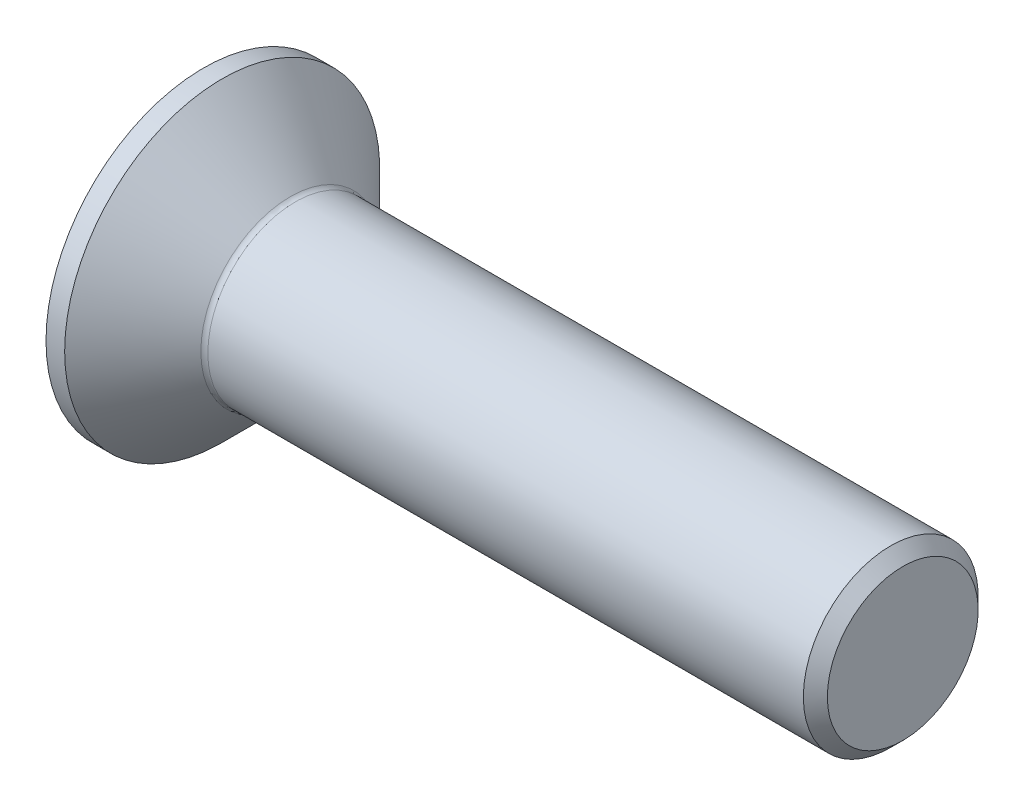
SolidWorks part; units mm, degrees
ref_plane "Plane1" through (0, 0, 0) normal (0, 0, 1) x (1, 0, 0)
ref_plane "Plane2" through (0, 0, 0) normal (0, 1, 0) x (1, 0, 0)
ref_plane "Plane3" through (0, 0, 0) normal (1, 0, 0) x (0, 0, -1)
sketch "BodySke" plane through (0, 0, 0) normal (0, 0, 1) x (1, 0, 0)
  line L0 (0, 0) -> (0, 18.025)
  line L1 (2.135, 18.025) -> (10.16, 10)
  line L2 (0, 18.025) -> (2.135, 18.025)
  line L3 (10.16, 10) -> (78.626, 10)
  line L4 (80, 8.626) -> (80, 0)
  line L5 (80, 0) -> (0, 0)
  line L6 (0, 0) -> (127, 0) construction
  line L7 (2.135, -18.025) -> (10.16, -10) construction
  line L8 (80, 8.626) -> (78.626, 10)
  line L9 (0, -18.025) -> (2.135, -18.025) construction
  line L10 (80, -8.626) -> (78.626, -10) construction
  line L11 (12.66, 16.35) -> (12.66, -5.875) construction
  line L12 (0, 19.05) -> (0, -3.175) construction
  dimension "D1" = 2.135
  dimension "Diameter" = 20
  dimension "Head_ht" = 10.16
  dimension "Length" = 80
  dimension "Body_ch_ang" = 45
  dimension "Head_dia" = 36.05
  dimension "Minor_dia" = 17.252
  dimension "Head_ang" = 90
  dimension "Advance" = 2.5
  dimension "Thread_nom" = 80
revolve "BaseBody" add sketch "BodySke" angle 360 about L6
fillet "Fillet1" radius 0.8 1 edges at (10.16, 0, 10)
sketch "Sketch2" plane through (0, 0, 0) normal (0, 0, 1) x (1, 0, 0)
  line L0 (0, 6) -> (5.6, 6)
  line L1 (5.6, 6) -> (9.0641, 0)
  line L2 (0, 0) -> (127, 0) construction
  line L3 (9.0641, 0) -> (0, 0)
  line L4 (0, 0) -> (0, 6)
  line L5 (0, -6) -> (5.6, -6) construction
  line L6 (0, 0) -> (47.625, 0) construction
  line L8 (0, 18.025) -> (0, -18.025) construction
  dimension "D2" = 60
  dimension "PreBroach_depth" = 5.6
  dimension "PreBroach_dia" = 12
revolve "PreBroach" cut sketch "Sketch2" angle 360 about L6
sketch "Sketch3" plane through (0, 0, 0) normal (-1, 0, 0) x (0, 0, 1)
  line L0 (-6, -3.4641) -> (-6, 3.4641)
  line L1 (-6, 3.4641) -> (0, 6.9282)
  line L2 (0, 6.9282) -> (6, 3.4641)
  line L3 (6, 3.4641) -> (6, -3.4641)
  line L4 (6, -3.4641) -> (0, -6.9282)
  line L5 (0, -6.9282) -> (-6, -3.4641)
  dimension "D1" = 6
  dimension "D2" = 6
  dimension "D3" = 12
  dimension "Hex_size" = 12
extrude "Hex" cut sketch "Sketch3" against normal blind 5.6
sketch "ThdSchSke" plane through (0, 0, 0) normal (0, 0, 1) x (1, 0, 0)
  line L0 (15.16, -8.626) -> (14.1979, -10)
  line L1 (15.16, -8.626) -> (16.1221, -10)
  line L2 (16.1221, -10) -> (16.1221, -12.5)
  line L3 (-3.175, 0) -> (5.1513, 0) construction
  line L4 (0, 18.025) -> (0, -18.025) construction
  line L5 (16.1221, -12.5) -> (14.1979, -12.5)
  line L6 (14.1979, -12.5) -> (14.1979, -10)
  dimension "Thread_minor" = 17.252
  dimension "Diameter" = 20
  dimension "Start" = 15.16
  dimension "SideAngle" = 55
  dimension "VeeAngle" = 70
  dimension "Overcut" = 25
revolve "ThreadSchematic" [suppressed] cut sketch "ThdSchSke" angle 360 about L3
pattern_linear "ThdSchPat" [suppressed]
equation "\"Thread_minor@ThreadCosmetic\"  =  \"Minor_dia@BodySke\""
equation "\"D1@Sketch3\" = \"Hex_size@Sketch3\" / 2"
equation "\"D2@Sketch3\" = \"D1@Sketch3\""
equation "\"D3@Sketch3\" = \"Hex_size@Sketch3\""
equation "\"Thread_length@ThreadCosmetic\" = ((sgn( (\"Length@BodySke\" - \"Advance@BodySke\" * 2.0 - \"Head_ht@BodySke\" ) - \"Thread_nom@BodySke\" )-1)*( (\"Length@BodySke\" - \"Advance@BodySke\" * 2.0 - \"Head_ht@BodySke\" "
equation "\"Thread_minor@ThdSchSke\" = \"Minor_dia@BodySke\""
equation "\"Diameter@ThdSchSke\" = \"Diameter@BodySke\""
equation "\"Overcut@ThdSchSke\" = \"Diameter@BodySke\" * 1.25"
equation "\"Start@ThdSchSke\" = 0.000001 + \"Length@BodySke\" - \"Thread_length@ThreadCosmetic\"  '---Countersunk---"
equation "\"Num_threads@ThdSchPat\" = int( \"Thread_length@ThreadCosmetic\" / \"Advance@BodySke\" + 0.999 )  + 1"
equation "\"Advance@ThdSchPat\" = \"Thread_length@ThreadCosmetic\" /  (\"Num_threads@ThdSchPat\" - 1) 'relax it"
equation "\"Num_threads@ThdSchPat\" = \"Num_threads@ThdSchPat\" - sgn( \"Num_threads@ThdSchPat\" - 1) '---chamfered tips only---"
